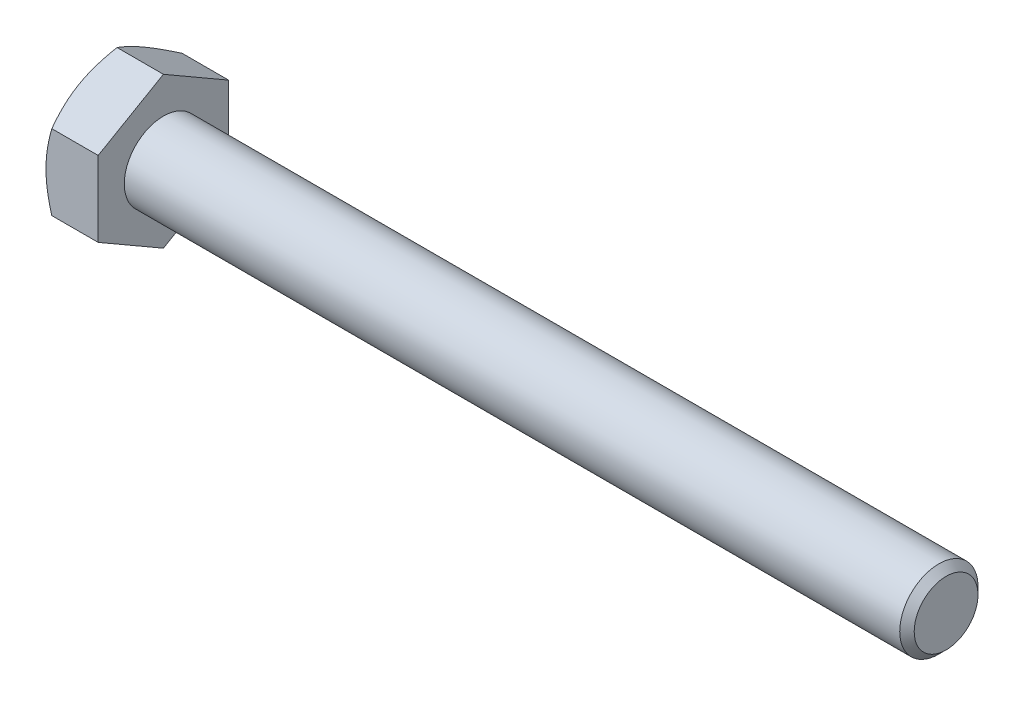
SolidWorks part; units mm, degrees
extrude "BaseHead" add sketch "Sketch1" along normal blind 4
sketch "Sketch1" plane through (0, 0, 0) normal (1, 0, 0) x (0, 0, -1)
  line L0 (5, 2.8868) -> (5, -2.8868)
  line L1 (-5, 2.8868) -> (-5, -2.8868)
  line L2 (5, -2.8868) -> (0, -5.7735)
  line L3 (0, -5.7735) -> (-5, -2.8868)
  line L4 (5, 2.8868) -> (0, 5.7735)
  line L5 (0, 5.7735) -> (-5, 2.8868)
ref_plane "Plane1" through (0, 0, 0) normal (0, 0, 1) x (1, 0, 0)
ref_plane "Plane2" through (0, 0, 0) normal (0, 1, 0) x (1, 0, 0)
ref_plane "Plane3" through (0, 0, 0) normal (1, 0, 0) x (0, 0, -1)
sketch "BodySke" plane through (0, 0, 0) normal (0, 0, 1) x (1, 0, 0)
  line L1 (0, 0) -> (64, 0)
  line L2 (0, 0) -> (0, 3)
  line L4 (64, 0) -> (64, 2.4455)
  line L5 (4, 5.7735) -> (4, 2.8868) construction
  line L6 (64, 2.4455) -> (63.4455, 3)
  line L7 (0, 0) -> (110.49, 0) construction
  line L8 (64, -2.4455) -> (63.4455, -3) construction
  line L9 (0, 2.8868) -> (0, -2.8868) construction
  line L10 (5, 15.24) -> (5, -1.27) construction
  line L11 (46, 15.24) -> (46, -1.27) construction
  line L12 (4, 2.8868) -> (4, -2.8868) construction
  line L15 (0, 3) -> (63.4455, 3)
revolve "BaseBody" add sketch "BodySke" angle 360 about L7
fillet "HeadFillet" [suppressed] radius 0.25
sketch "Sketch3" plane through (0, 0, 0) normal (0, 0, 1) x (1, 0, 0)
  line L0 (0, 5) -> (3.3333, 10.7735)
  line L1 (0, 5.7735) -> (0, 2.8868) construction
  line L2 (3.3333, 10.7735) -> (3.3333, 15.7735)
  line L3 (3.3333, 15.7735) -> (-10, 15.7735)
  line L4 (-10, 15.7735) -> (-10, 5)
  line L5 (-10, 5) -> (0, 5)
  line L6 (0, 0) -> (99.06, 0) construction
  line L7 (4, 5.7735) -> (0, 5.7735) construction
revolve "HeadChamfer" cut sketch "Sketch3" angle 360 about L6
sketch "ThdSchSke" plane through (0, 0, 0) normal (0, 0, 1) x (1, 0, 0)
  line L0 (46, -2.4455) -> (45.6117, -3)
  line L1 (46, -2.4455) -> (46.3883, -3)
  line L2 (46.3883, -3) -> (46.3883, -3.75)
  line L3 (-3.175, 0) -> (5.1513, 0) construction
  line L5 (46.3883, -3.75) -> (45.6117, -3.75)
  line L6 (45.6117, -3.75) -> (45.6117, -3)
revolve "ThreadSchematic" [suppressed] cut sketch "ThdSchSke" angle 360 about L3
pattern_linear "ThdSchPat" [suppressed]
equation "\"D3@Sketch1\" = \"Width_flats@Sketch1\" / 2"
equation "\"D4@Sketch1\" = \"D3@Sketch1\""
equation "\"D5@Sketch1\" = \"D4@Sketch1\""
equation "\"Thread_minor@ThreadCosmetic\" = \"Minor_dia@BodySke\""
equation "\"D1@Sketch3\" = \"Width_flats@Sketch1\" / 2"
equation "\"Thread_length@ThreadCosmetic\" = ((sgn( (\"Length@BodySke\" - \"Advance@BodySke\" ) - \"Thread_nom@BodySke\" )-1)*( (\"Length@BodySke\" - \"Advance@BodySke\" ) - \"Thread_nom@BodySke\" ))/-2+ \"Thread_nom@BodySke\""
equation "\"Thread_minor@ThdSchSke\" = \"Minor_dia@BodySke\""
equation "\"Diameter@ThdSchSke\" = \"Diameter@BodySke\""
equation "\"Overcut@ThdSchSke\" = \"Diameter@BodySke\" * 1.25"
equation "\"Start@ThdSchSke\" = \"Head_ht@BaseHead\" + \"Length@BodySke\" - \"Thread_length@ThreadCosmetic\"  '---Non-countersunk---"
equation "\"Num_threads@ThdSchPat\" = int( \"Thread_length@ThreadCosmetic\" / \"Advance@BodySke\" + 0.999 )  + 1"
equation "\"Advance@ThdSchPat\" = \"Thread_length@ThreadCosmetic\" /  (\"Num_threads@ThdSchPat\" - 1) 'relax it"
equation "\"Num_threads@ThdSchPat\" = \"Num_threads@ThdSchPat\" - sgn( \"Num_threads@ThdSchPat\" - 1) '---chamfered tips only---"
